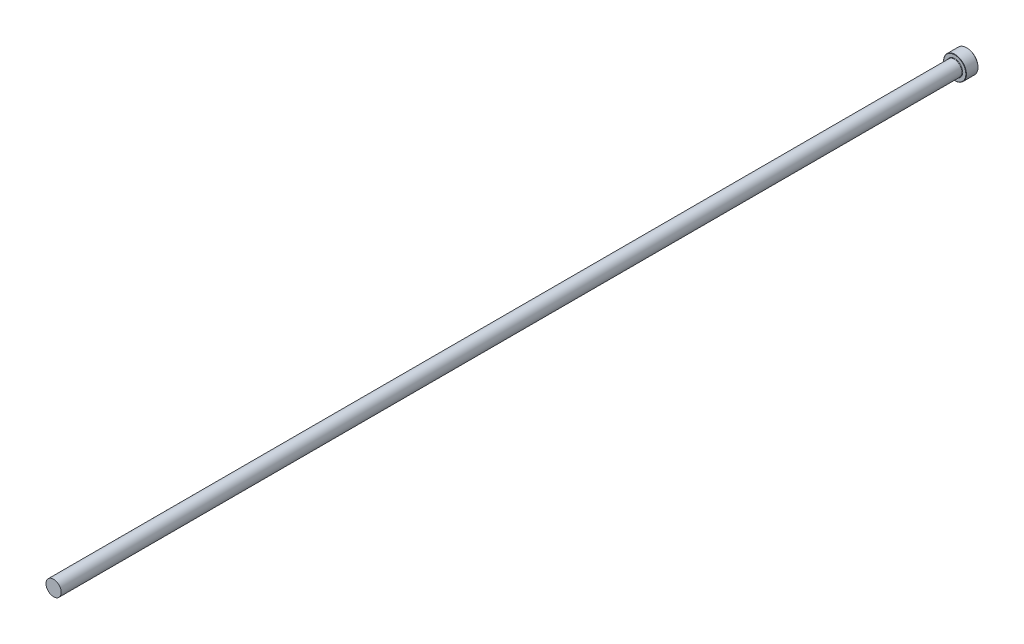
SolidWorks part; units mm, degrees
ref_plane "Front Plane" through (0, 0, 0) normal (0, 0, 1) x (1, 0, 0)
ref_plane "Top Plane" through (0, 0, 0) normal (0, 1, 0) x (1, 0, 0)
ref_plane "Right Plane" through (0, 0, 0) normal (1, 0, 0) x (0, 0, -1)
sketch "Sketch1" plane through (0, 0, 0) normal (1, 0, 0) x (0, 0, -1)
  line L0 (0, 0) -> (0, 7.5)
  line L1 (0, 7.15) -> (0, -7.15) construction
  line L2 (0, 7.5) -> (-8, 7.5)
  line L3 (-8, 7.5) -> (-8, 5.3)
  line L4 (-8.3, 5) -> (-600, 5)
  line L5 (-600, 5) -> (-600, 0)
  line L6 (7.15, 0) -> (-7.15, 0) construction
  line L7 (-600, 0) -> (0, 0)
  line L8 (-109.0506, 0) -> (16.9928, 0) construction
  arc A0 (-8, 5.3) -> (-8.3, 5) centre (-8.3, 5.3) cw
  dimension "D1" = 0.3
  dimension "D2" = 15
  dimension "D3" = 10
  dimension "D4" = 600
  dimension "D5" = 8
revolve "Revolve1" add sketch "Sketch1" angle 360 about L8
chamfer "Chamfer1" distance 0.2 angle 45 2 edges at (7.5, 0, 0) (7.5, 0, 8)
